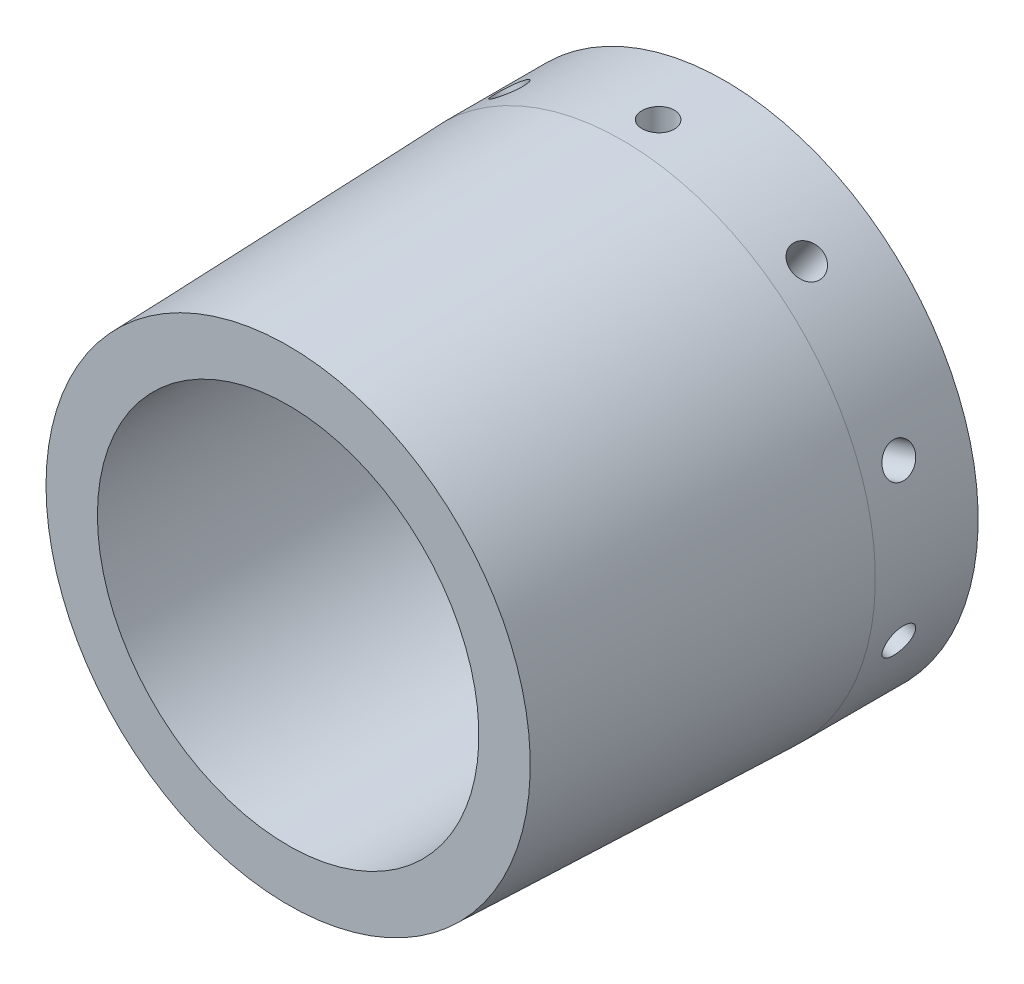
SolidWorks part; units mm, degrees
ref_plane "Front Plane" through (0, 0, 0) normal (0, 0, 1) x (1, 0, 0)
ref_plane "Top Plane" through (0, 0, 0) normal (0, 1, 0) x (1, 0, 0)
ref_plane "Right Plane" through (0, 0, 0) normal (1, 0, 0) x (0, 0, -1)
sketch "Sketch2" plane through (0, 0, 0) normal (0, 1, 0) x (1, 0, 0)
  line L0 (0, 0) -> (-9.3345, 0)
  line L1 (-9.3345, 0) -> (-9.3345, -15.367)
  line L2 (0, 0) -> (0, -65.3002)
  line L3 (0, -65.3002) -> (-7.6835, -65.3002)
  line L4 (-9.3345, -15.367) -> (-7.6835, -65.3002)
  line L5 (28.5115, 0) -> (28.5115, -65.3002) construction
  dimension "D1" = 15.367
  dimension "D2" = 9.3345
  dimension "D3" = 65.3002
  dimension "D4" = 7.6835
  dimension "D5" = 28.5115
revolve "Revolve1" add sketch "Sketch2" angle 360 about L5
ref_plane "Plane1" through (0, 37.846, 0) normal (0, 1, 0) x (1, 0, 0)
sketch "Sketch3" plane through (0, 37.846, 0) normal (0, 1, 0) x (1, 0, 0)
  line L0 (66.3575, 0) -> (-9.3345, 0) construction
  line L8 (28.5115, -65.3002) -> (28.5115, 0) construction
  circle A0 centre (28.5115, -10) radius 2.413
  point P5 (28.5115, 0)
  dimension "D1" = 4.826
  dimension "D2" = 10
extrude "Cut-Extrude2" cut sketch "Sketch3" against normal up to surface (9.3345 mm away)
pattern_circular "CirPattern3" count 10 over 360 about axis through (28.5115, 0, 0) along (0, 0, -1) of "Cut-Extrude2"
